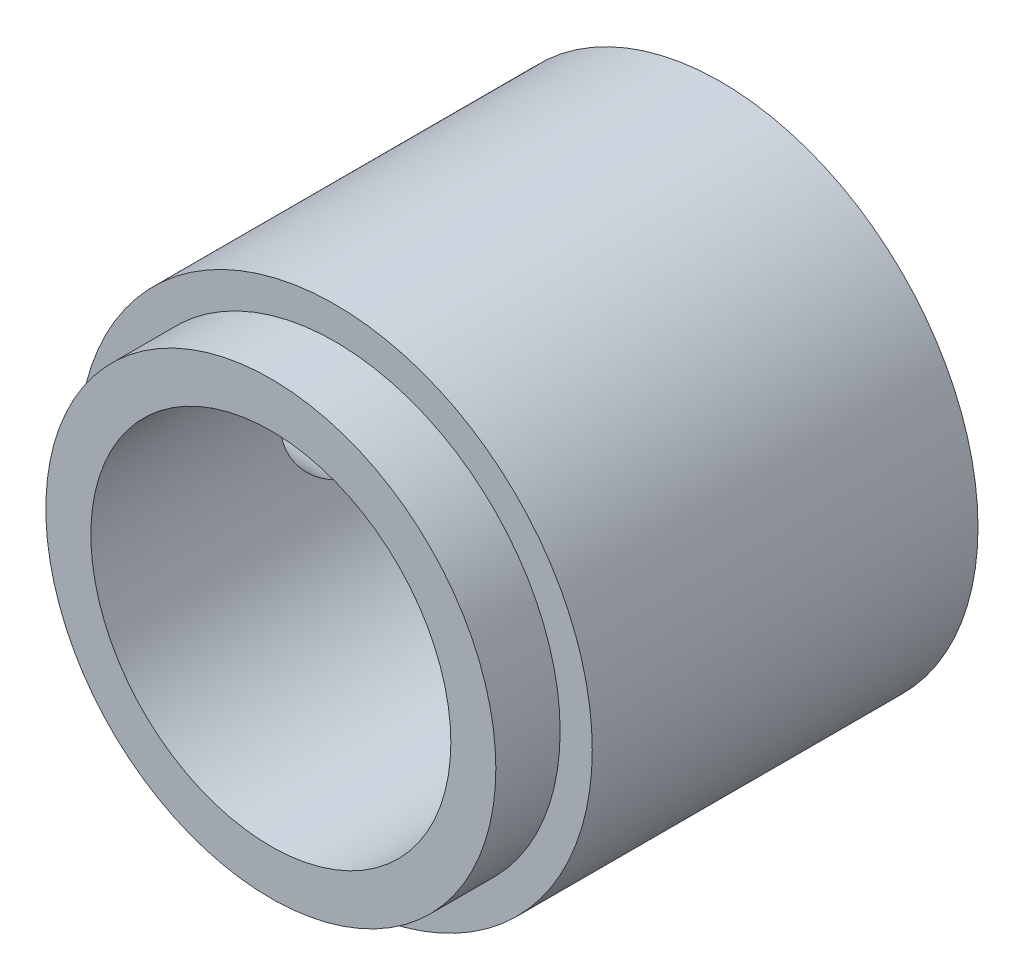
SolidWorks part; units mm, degrees
ref_plane "Face" through (0, 0, 0) normal (0, 0, 1) x (1, 0, 0)
ref_plane "Dessus" through (0, 0, 0) normal (0, 1, 0) x (1, 0, 0)
ref_plane "Droite" through (0, 0, 0) normal (1, 0, 0) x (0, 0, -1)
sketch "Esquisse1" plane through (0, 0, 0) normal (0, 0, 1) x (1, 0, 0)
  circle A0 centre (0, 0) radius 20
  circle A1 centre (0, 0) radius 14
  dimension "D1" = 28
  dimension "D2" = 40
extrude "Base-Extrusion" add sketch "Esquisse1" along normal blind 30
sketch "Esquisse2" plane through (0, 0, 30) normal (0, 0, 1) x (1, 0, 0)
  circle A0 centre (0, 0) radius 14
  circle A1 centre (0, 0) radius 17.5
  circle A3 centre (0, 0) radius 14 construction
  dimension "D1" = 35
extrude "Boss.-Extru.1" add sketch "Esquisse2" along normal blind 5
sketch "Esquisse3" plane through (0, 0, 0) normal (1, 0, 0) x (0, 0, -1)
  line L0 (-30, 0) -> (0, 0) construction
  line L2 (0, -14) -> (0, 14) construction
  circle A0 centre (-15, 0) radius 5.25
  dimension "D2" = 10.5
  dimension "D1" = 15
extrude "Enlèv. mat.-Extru.1" cut sketch "Esquisse3" against normal blind 25
